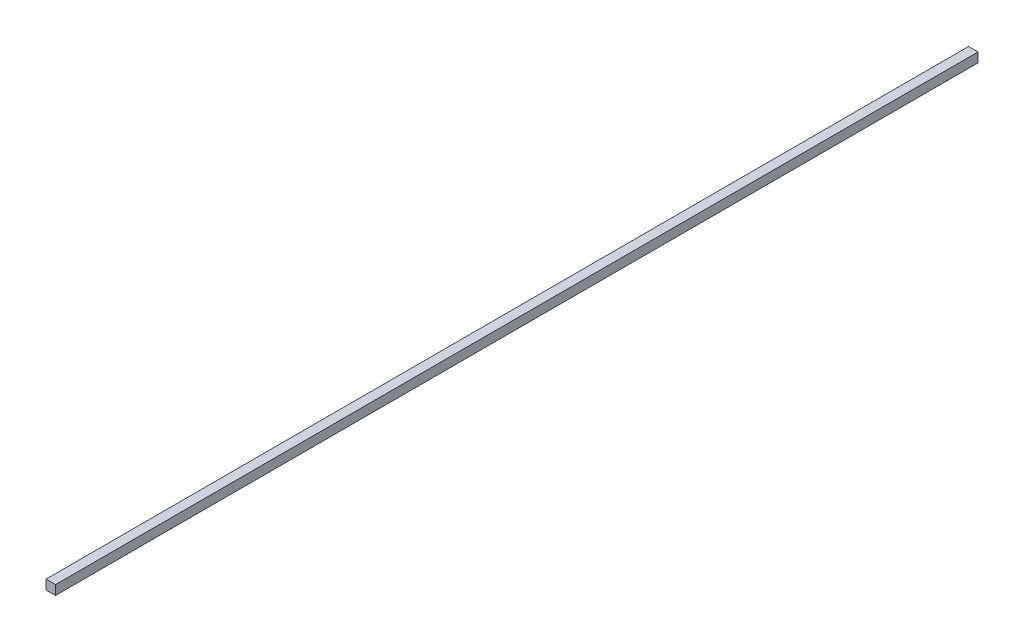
SolidWorks part; units mm, degrees
ref_plane "Plan de face" through (0, 0, 0) normal (0, 0, 1) x (1, 0, 0)
ref_plane "Plan de dessus" through (0, 0, 0) normal (0, 1, 0) x (1, 0, 0)
ref_plane "Plan de droite" through (0, 0, 0) normal (1, 0, 0) x (0, 0, -1)
sketch "Esquisse1" plane through (0, 0, 0) normal (0, 0, 1) x (1, 0, 0)
  line L1 (-1, 1) -> (1, 1)
  line L2 (-1, 1) -> (-1, -1)
  line L3 (-1, -1) -> (1, -1)
  line L4 (1, 1) -> (1, -1)
  point P4 (0, 1)
  point P5 (-1, 0)
  dimension "D1" = 2
  dimension "D2" = 2
extrude "Extrusion1" add sketch "Esquisse1" along normal mid plane 195
